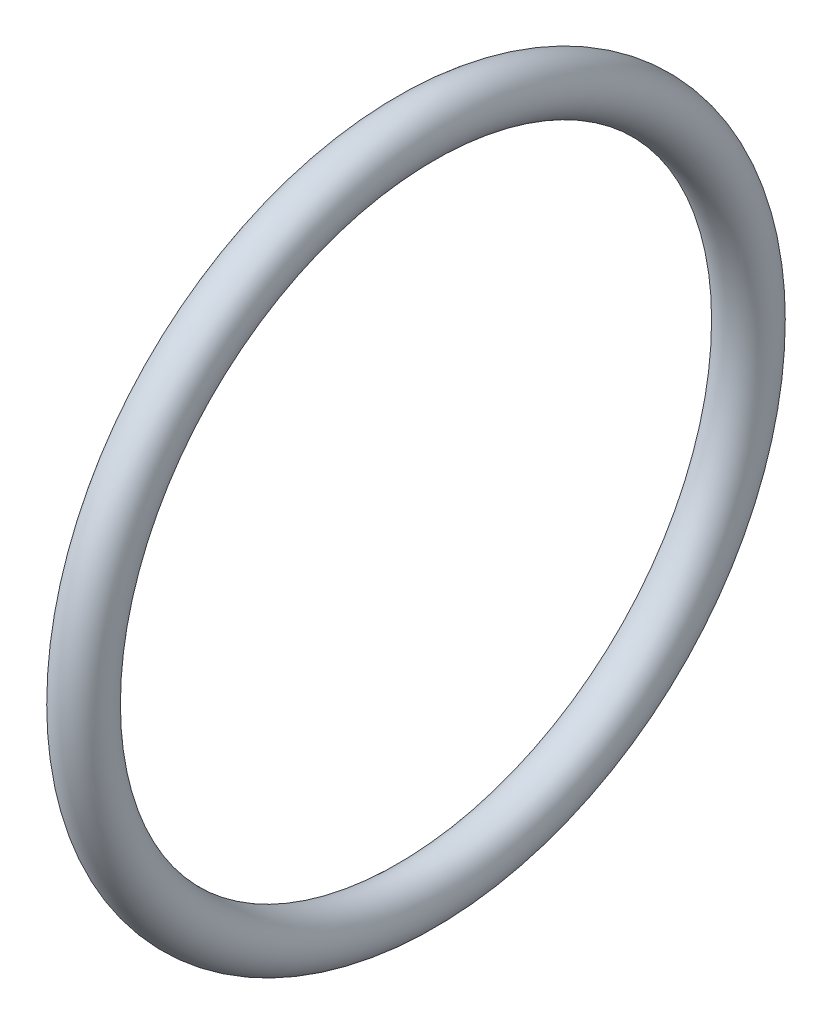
SolidWorks part; units mm, degrees
ref_plane "Plan de face" through (0, 0, 0) normal (0, 0, 1) x (1, 0, 0)
ref_plane "Plan de dessus" through (0, 0, 0) normal (0, 1, 0) x (1, 0, 0)
ref_plane "Plan de droite" through (0, 0, 0) normal (1, 0, 0) x (0, 0, -1)
sketch "Esquisse1" plane through (0, 0, 0) normal (0, 0, 1) x (1, 0, 0)
  line L0 (-11.0938, 0) -> (9.6065, 0) construction
  circle A0 centre (0, 25.5) radius 2
  dimension "D1" = 4
  dimension "D2" = 25.5
revolve "Révolution1" add sketch "Esquisse1" angle 360 about L0
